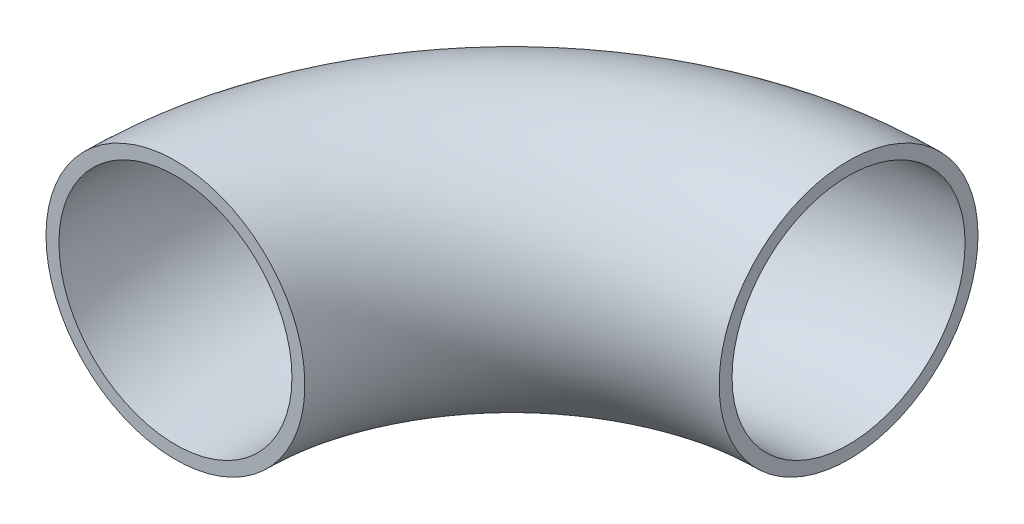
SolidWorks part; units mm, degrees
ref_plane "Plan de face" through (0, 0, 0) normal (0, 0, 1) x (1, 0, 0)
ref_plane "Plan de dessus" through (0, 0, 0) normal (0, 1, 0) x (1, 0, 0)
ref_plane "Plan de droite" through (0, 0, 0) normal (1, 0, 0) x (0, 0, -1)
sketch "Esquisse1" plane through (0, 0, 0) normal (0, 0, 1) x (1, 0, 0)
  circle A0 centre (0, 0) radius 15
  dimension "D1" = 30
sketch "Esquisse2" plane through (0, 0, 0) normal (0, 1, 0) x (1, 0, 0)
  line L0 (0, 0) -> (0, -33.9796) construction
  line L1 (0, 0) -> (25.994, 0) construction
  line L2 (24.7719, 39) -> (2.8324, 39) construction
  arc A0 (0, 0) -> (39, 39) centre (39, 0) cw
  dimension "D1" = 39
sweep "Balayage-Mince2" add profiles "Esquisse1" path "Esquisse2" parameters "D1"=1.5
